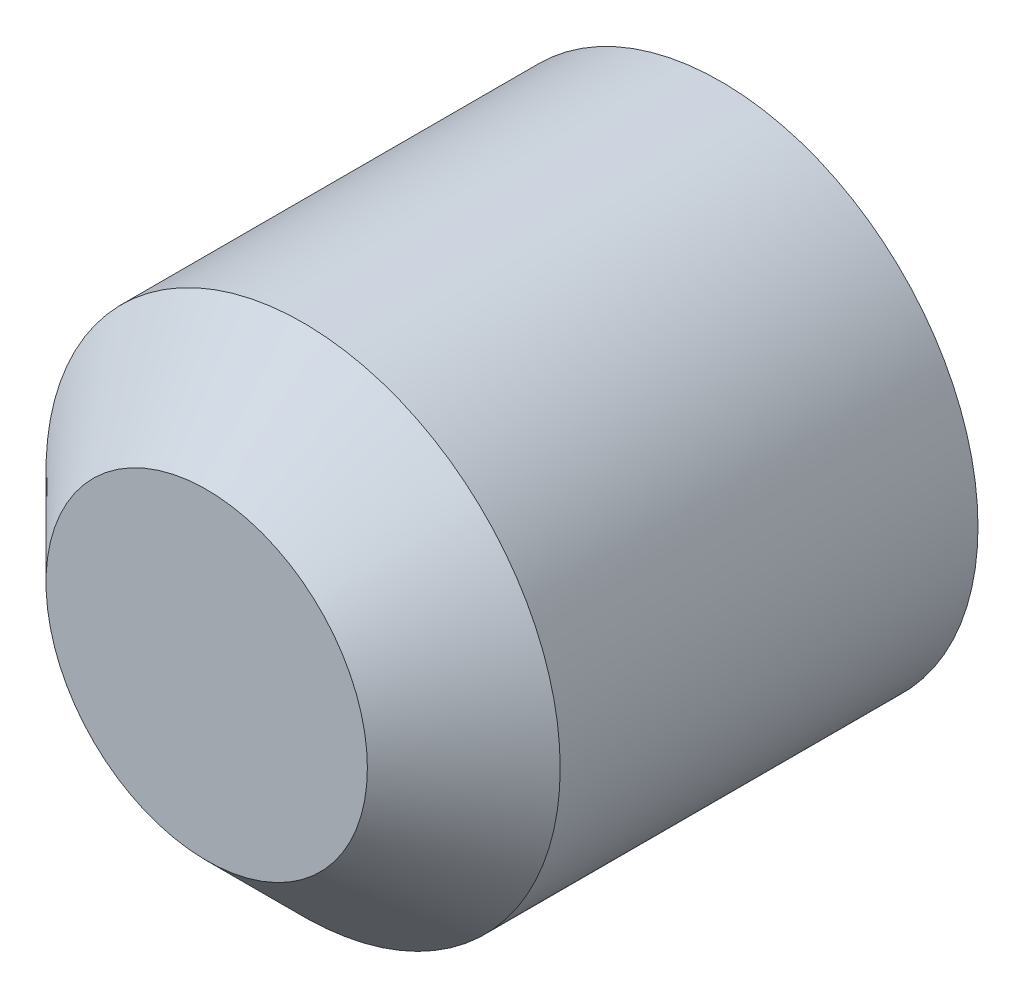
SolidWorks part; units mm, degrees
ref_plane "Plan1" through (0, 0, 0) normal (0, 0, 1) x (1, 0, 0)
ref_plane "Plan2" through (0, 0, 0) normal (0, 1, 0) x (1, 0, 0)
ref_plane "Plan3" through (0, 0, 0) normal (1, 0, 0) x (0, 0, -1)
sketch "Esquisse1" plane through (0, 0, 0) normal (0, 0, 1) x (1, 0, 0)
  circle A0 centre (0, 0) radius 2
  dimension "D1" = 4
extrude "Base-Extrusion" add sketch "Esquisse1" along normal blind 4
chamfer "Chanfrein1" distance 0.75 angle 45
